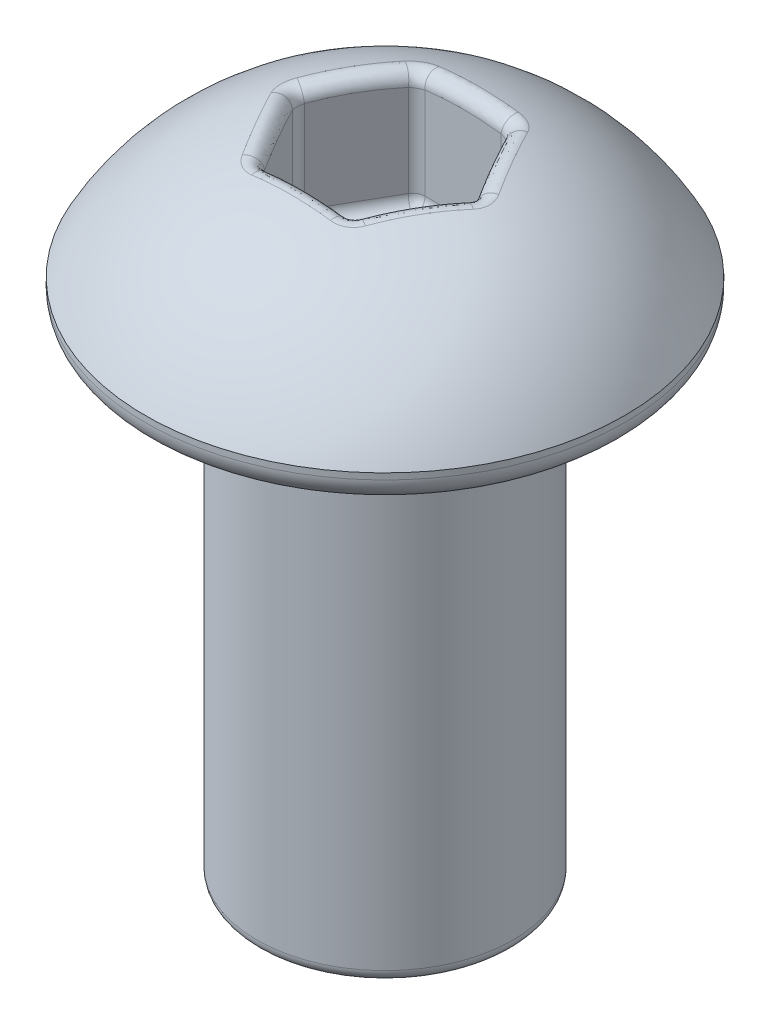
SolidWorks part; units mm, degrees
ref_plane "Front" through (0, 0, 0) normal (0, 0, 1) x (1, 0, 0)
ref_plane "Top" through (0, 0, 0) normal (0, 1, 0) x (1, 0, 0)
ref_plane "Right" through (0, 0, 0) normal (1, 0, 0) x (0, 0, -1)
sketch "草图1" plane through (0, 0, 0) normal (0, 1, 0) x (1, 0, 0)
  circle A0 centre (0, 0) radius 2.085
  dimension "螺丝直径" = 4.17
extrude "凸台-拉伸1" add sketch "草图1" against normal blind 8
sketch "草图2" plane through (0, 0, 0) normal (0, 0, 1) x (1, 0, 0)
  line L0 (0, -1000) -> (0, 49000) construction
  line L1 (-1000, 0) -> (49000, 0) construction
  line L2 (-3.9, 0) -> (3.9, 0) construction
  line L3 (-999.5875, 2.5) -> (49000.4125, 2.5) construction
  line L4 (-3.9, -1000) -> (-3.9, 49000) construction
  line L5 (3.9, -1000) -> (3.9, 49000) construction
  line L6 (-3.9, 0.5) -> (3.9, 0.5) construction
  line L7 (1.25, 2.5) -> (-1.25, 2.5)
  line L8 (-3.9, 0.5) -> (-3.9, 0.4)
  line L9 (-3.5, 0) -> (3.5, 0)
  line L10 (3.9, 0.4) -> (3.9, 0.5)
  line L11 (0, 2.5) -> (0, 0)
  arc A0 (3.5, 0) -> (3.9, 0.4) centre (3.5, 0.4) ccw
  arc A1 (-3.9, 0.4) -> (-3.5, 0) centre (-3.5, 0.4) ccw
  arc A2 (-3.9, 0.5) -> (-1.25, 2.5) centre (-0.3827, -1.4048) cw
  arc A3 (3.9, 0.5) -> (1.25, 2.5) centre (0.3827, -1.4048) ccw
  point P18 (0, 2.5)
  dimension "D2" = 0.4
  dimension "D3" = 4
  dimension "D1" = 0.5
  dimension "螺丝头半径" = 3.9
  dimension "螺丝头厚度" = 2.5
  dimension "六角直径" = 2.5
revolve "旋转1" add sketch "草图2" angle 360 about L0
sketch "草图3" plane through (0, 2.5, 0) normal (0, 1, 0) x (1, 0, 0)
  line L1 (1.4665, 0) -> (0.7332, 1.27)
  line L2 (0.7332, 1.27) -> (-0.7332, 1.27)
  line L3 (-0.7332, 1.27) -> (-1.4665, 0)
  line L4 (-1.4665, 0) -> (-0.7332, -1.27)
  line L5 (-0.7332, -1.27) -> (0.7332, -1.27)
  line L6 (0.7332, -1.27) -> (1.4665, 0)
  circle A0 centre (0, 0) radius 1.27 construction
  dimension "六角直径2" = 2.54
extrude "切除-拉伸1" cut sketch "草图3" against normal blind 2
fillet "圆角1" radius 0.2 19 edges at (1.0999, 0.5, -0.635) (-1.0999, 0.5, -0.635) (-1.4665, 1.4728, 0) (-1.0999, 0.5, 0.635) (-0.7332, 1.4728, 1.27) (0, 0.5, 1.27) (0.7332, 1.4728, 1.27) (1.0999, 0.5, 0.635) (1.4665, 1.4728, 0) (0.7332, 1.4728, -1.27) (0, 0.5, -1.27) (-0.7332, 1.4728, -1.27) (0, -8, 2.085)
other "冻结***"
equation "\"2。8\"=3"
